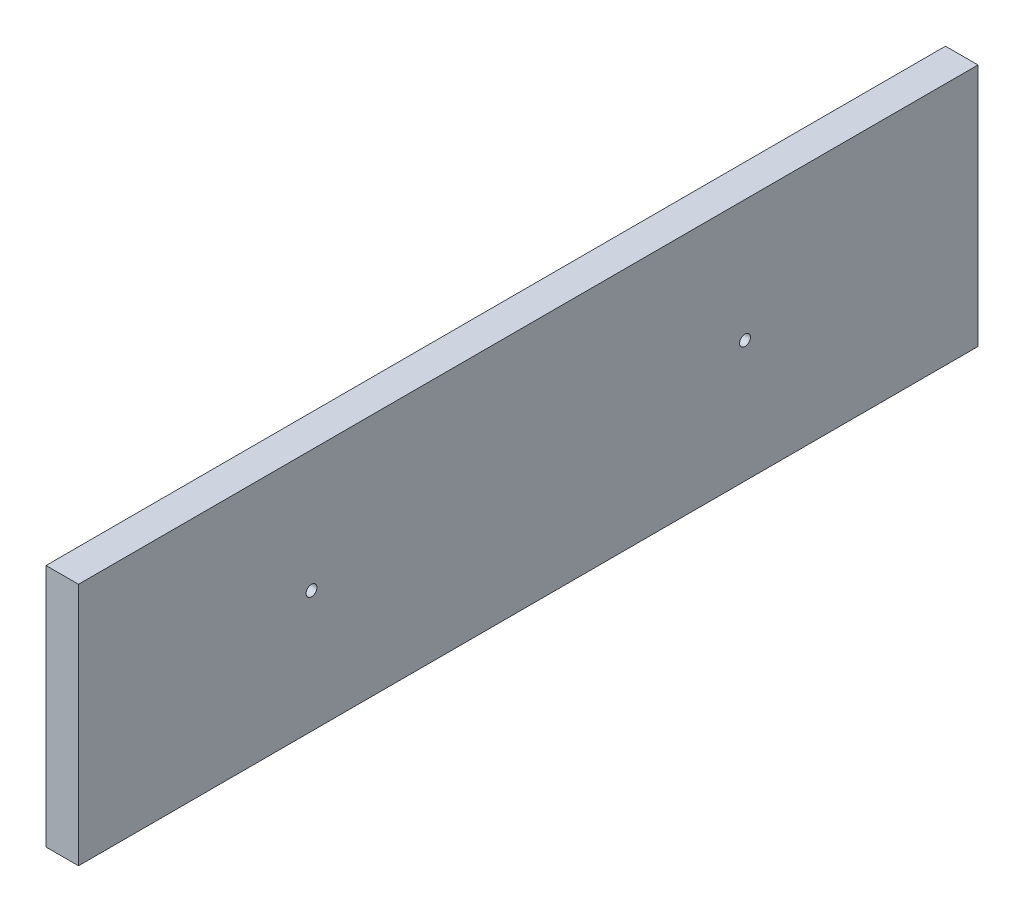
SolidWorks part; units mm, degrees
ref_plane "Front Plane" through (0, 0, 0) normal (0, 0, 1) x (1, 0, 0)
ref_plane "Top Plane" through (0, 0, 0) normal (0, 1, 0) x (1, 0, 0)
ref_plane "Right Plane" through (0, 0, 0) normal (1, 0, 0) x (0, 0, -1)
sketch "Sketch2" plane through (0, 0, 0) normal (0, 0, 1) x (1, 0, 0)
  line L1 (0, 0) -> (38.1, 0)
  line L2 (0, 0) -> (0, 285.75)
  line L3 (0, 285.75) -> (38.1, 285.75)
  line L4 (38.1, 0) -> (38.1, 285.75)
  line L5 (0, 0) -> (38.1, 285.75) construction
  line L6 (0, 285.75) -> (38.1, 0) construction
  point P4 (19.05, 142.875)
extrude "Boss-Extrude2" add sketch "Sketch2" along normal blind 1054.1
sketch "Sketch3" plane through (38.1, 0, 0) normal (1, 0, 0) x (0, 0, -1)
  line L0 (-1054.1, 142.875) -> (-781.05, 142.875) construction
  line L1 (-1054.1, 0) -> (-1054.1, 285.75) construction
  line L2 (0, 142.875) -> (-273.05, 142.875) construction
  line L3 (0, 0) -> (0, 285.75) construction
  circle A0 centre (-781.05, 142.875) radius 6.35
  circle A1 centre (-273.05, 142.875) radius 6.35
extrude "Cut-Extrude1" cut sketch "Sketch3" against normal through all
equation "\"system_width\"= 7ft + 10 "
equation "\"system_length\"= 95.5"
equation "\"module_board_length\"= 11.25in"
equation "\"module_board_width\"= 1.5in"
equation "\"module_width\"= (\"system_width\" -  2* \"module_trim_thickness\") / 2"
equation "\"module_length\"= (\"system_top_length\" - \"module_trim_thickness\")/ 2"
equation "\"module_board_long_depth\"= \"module_length\" - \"module_lip_width\""
equation "\"module_board_short_depth\"= \"module_width\" - ( 2 * \"module_board_width\" ) - \"module_lip_width\""
equation "\"D1@Sketch2\"=\"module_board_length\""
equation "\"D2@Sketch2\"=\"module_board_width\""
equation "\"D1@Boss-Extrude2\"=\"module_board_short_depth\""
equation "\"module_board_hole\"= 0.5in"
equation "\"module_board_hole_position\"= ( ( \"module_width\" - \"module_board_hole_seperation\" ) / 2 ) + \"module_board_width\"/2"
equation "\"module_board_hole_seperation\"= 20in"
equation "\"D1@Sketch3\"=\"module_board_hole_seperation\""
equation "\"D2@Sketch3\"=\"module_board_hole\""
equation "\"system_step_width\"= 3ft"
equation "\"system_top_length\"= \"system_length\" - \"system_step_length\""
equation "\"module_top_thickness\"= 0.75in"
equation "\"module_lip_width\"= 1.5in"
equation "\"module_trim_thickness\"= 1in"
equation "\"module_trim_height\"= 14in"
equation "\"module_top_overhang\"= 4.5in"
equation "\"module_trim_angle\"= 45deg"
equation "\"step_board_length\"= 5.5in"
equation "\"step_board_width\"= 1.5in"
equation "\"system_step_length\"= 2ft+11.5"
equation "\"step_module_width\"= \"module_width\""
equation "\"step_module_length\"= \"system_step_length\" - \"module_trim_thickness\""
equation "\"step_board_long_depth\"= \"step_module_width\" - (2 * \"module_board_width\") - \"module_lip_width\""
equation "\"step_board_short_depth\"= \"step_module_length\" - \"module_lip_width\""
equation "\"step_trim_height\"= 8in"
